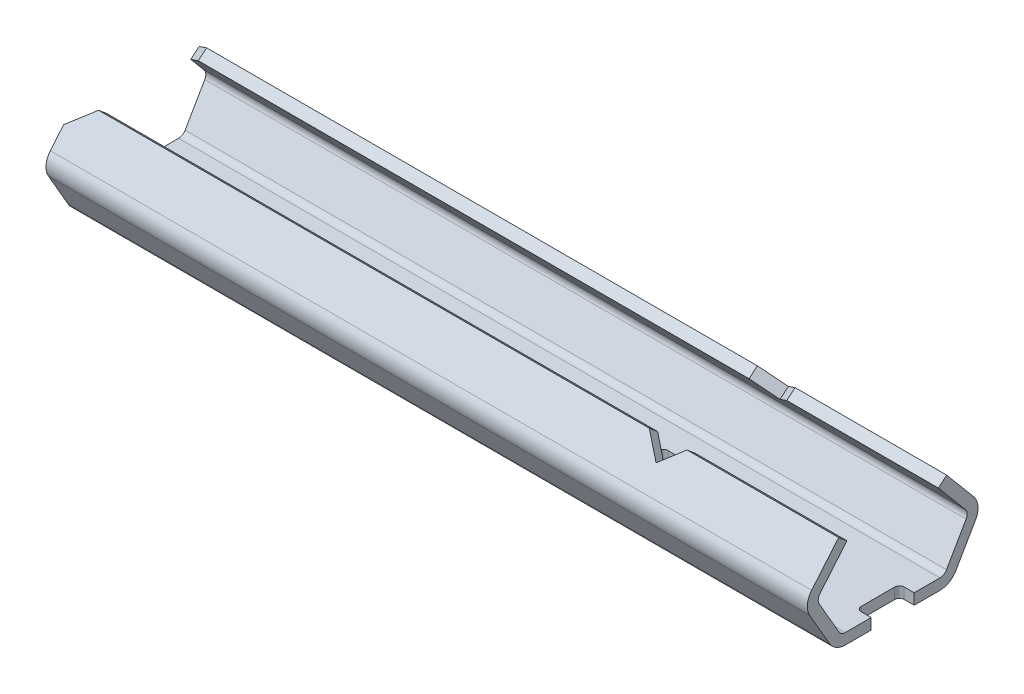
SolidWorks part; units mm, degrees
other "NONE"
ref_plane "Front Plane" through (0, 0, 0) normal (0, 0, 1) x (1, 0, 0)
ref_plane "Top Plane" through (0, 0, 0) normal (0, 1, 0) x (1, 0, 0)
ref_plane "Right Plane" through (0, 0, 0) normal (1, 0, 0) x (0, 0, -1)
imported_body "Imported1"
sketch "Sketch1" plane through (0, 0, 0) normal (0, 1, 0) x (1, 0, 0)
  line L0 (229.2625, -10.6266) -> (5.7975, -10.6266)
  line L5 (5.7975, -10.6266) -> (5.7975, -31.3314)
  line L6 (5.7975, -31.3314) -> (229.2625, -31.3314)
  line L7 (229.2625, -10.6266) -> (229.2625, -31.3314)
extrude "Cut-Extrude1" cut sketch "Sketch1" along normal blind 16.256
sketch "Sketch2" plane through (0, 0, 0) normal (1, 0, 0) x (0, 0, -1)
  circle A0 centre (-20.8705, 5.5037) radius 5.08
  dimension "D1" = 10.16
